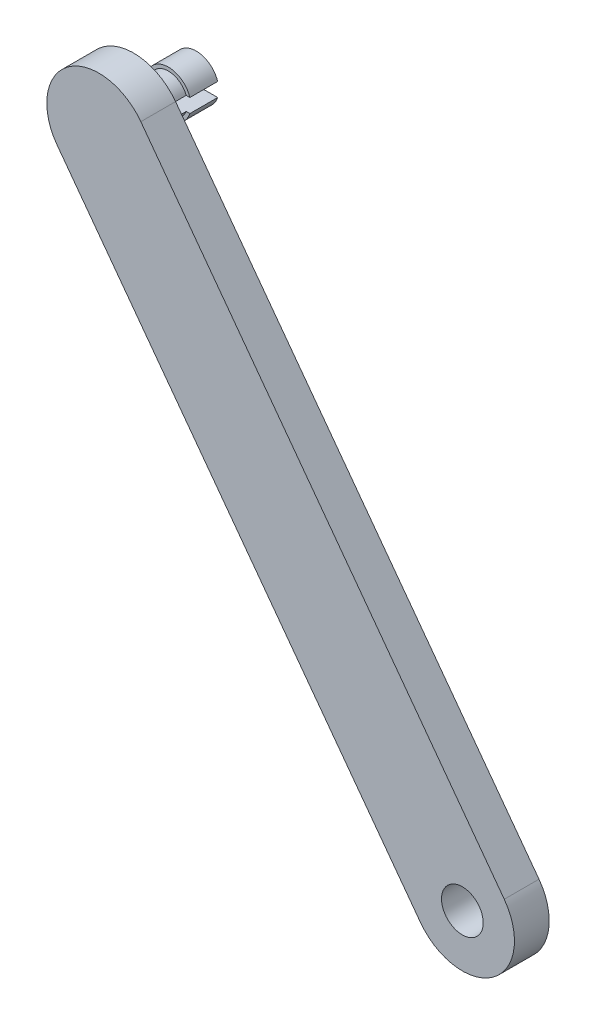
SolidWorks part; units mm, degrees
ref_plane "Plan de face" through (0, 0, 0) normal (0, 0, 1) x (1, 0, 0)
ref_plane "Plan de dessus" through (0, 0, 0) normal (0, 1, 0) x (1, 0, 0)
ref_plane "Plan de droite" through (0, 0, 0) normal (1, 0, 0) x (0, 0, -1)
sketch "Esquisse1" plane through (0, 0, 0) normal (0, 0, 1) x (1, 0, 0)
  line L0 (0, -20) -> (-52.3085, 50.7659) construction
  line L1 (-6.0312, -24.4581) -> (-58.3397, 46.3078)
  line L2 (6.0312, -15.5419) -> (-46.2773, 55.2241)
  arc A0 (-6.0312, -24.4581) -> (6.0312, -15.5419) centre (0, -20) ccw
  arc A1 (-46.2773, 55.2241) -> (-58.3397, 46.3078) centre (-52.3085, 50.7659) ccw
  point P4 (-26.1543, 15.383)
  dimension "D1" = 15
extrude "Boss.-Extru.1" add sketch "Esquisse1" along normal blind 5
sketch "Esquisse2" plane through (0, 0, 5) normal (0, 0, 1) x (1, 0, 0)
  circle A0 centre (0, -20) radius 3
  dimension "D1" = 6
extrude "Enlèv. mat.-Extru.1" cut sketch "Esquisse2" against normal blind 5
sketch "Esquisse3" plane through (0, 0, 0) normal (0, 0, -1) x (-1, 0, 0)
  circle A0 centre (52.3085, 50.7659) radius 2.75
  dimension "D1" = 5.5
extrude "Boss.-Extru.2" add sketch "Esquisse3" along normal blind 5
sketch "Esquisse4" plane through (0, 0, -5) normal (0, 0, -1) x (-1, 0, 0)
  circle A0 centre (52.3085, 50.7659) radius 3.25
  dimension "D1" = 6.5
extrude "Boss.-Extru.3" add sketch "Esquisse4" along normal blind 4
sketch "Esquisse5" plane through (0, 0, -9) normal (0, 0, -1) x (-1, 0, 0)
  line L1 (47.3085, 51.7659) -> (57.3085, 51.7659)
  line L2 (47.3085, 51.7659) -> (47.3085, 49.7659)
  line L3 (47.3085, 49.7659) -> (57.3085, 49.7659)
  line L4 (57.3085, 51.7659) -> (57.3085, 49.7659)
  dimension "D1" = 1
  dimension "D2" = 1
  dimension "D3" = 10
  dimension "D4" = 5
extrude "Enlèv. mat.-Extru.2" cut sketch "Esquisse5" against normal blind 9
